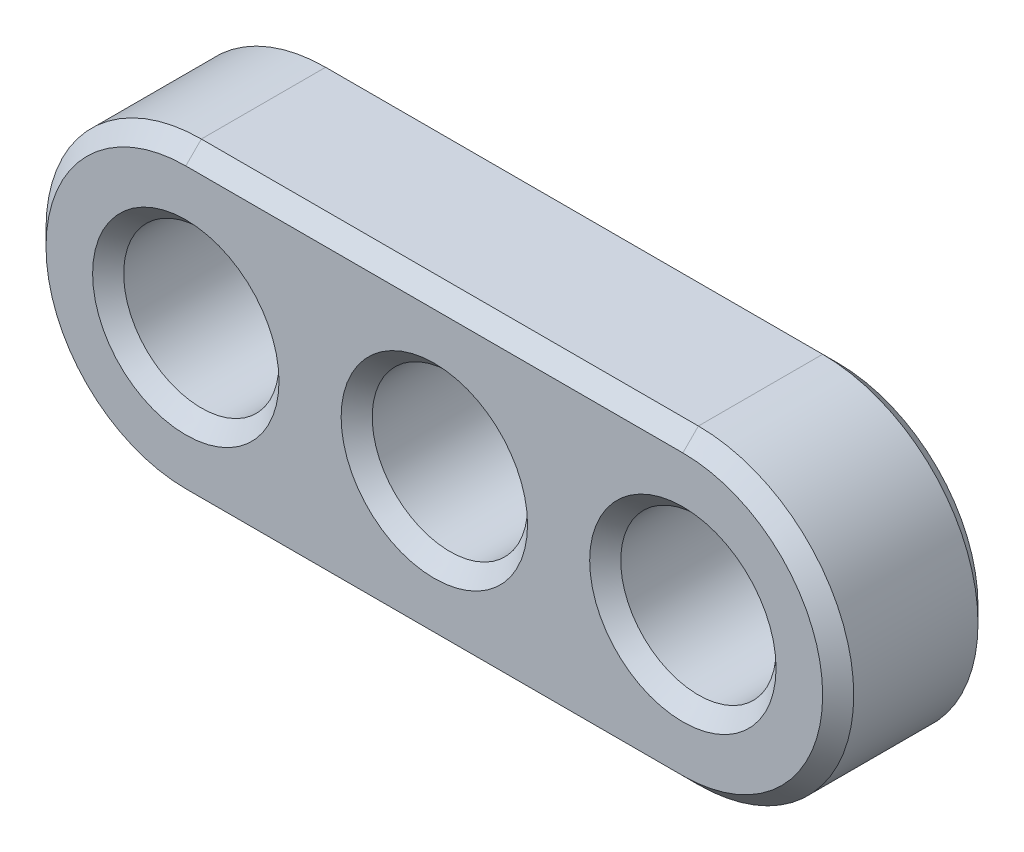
SolidWorks part; units mm, degrees
ref_plane "Plan de face" through (0, 0, 0) normal (0, 0, 1) x (1, 0, 0)
ref_plane "Plan de dessus" through (0, 0, 0) normal (0, 1, 0) x (1, 0, 0)
ref_plane "Plan de droite" through (0, 0, 0) normal (1, 0, 0) x (0, 0, -1)
sketch "Esquisse1" plane through (0, 0, 0) normal (0, 0, 1) x (1, 0, 0)
  line L0 (12, 0) -> (-12, 0) construction
  line L1 (12, -7.5) -> (-12, -7.5)
  line L2 (12, 7.5) -> (-12, 7.5)
  arc A0 (12, -7.5) -> (12, 7.5) centre (12, 0) ccw
  arc A1 (-12, 7.5) -> (-12, -7.5) centre (-12, 0) ccw
  circle A2 centre (-12, 0) radius 3.75
  circle A3 centre (0, 0) radius 3.75
  circle A4 centre (12, 0) radius 3.75
  point P2 (0, 0)
  dimension "D2" = 7.5
  dimension "D3" = 7.5
  dimension "D1" = 24
extrude "Boss.-Extru.1" add sketch "Esquisse1" along normal blind 7.5
chamfer "Chanfrein1" distance 0.75 angle 45 14 edges at (15.75, 0, 0) (3.75, 0, 0) (-8.25, 0, 0) (0, 7.5, 0) (-19.5, 0, 0) (0, -7.5, 0) (19.5, 0, 0) (15.75, 0, 7.5) (-8.25, 0, 7.5) (0, -7.5, 7.5) (-19.5, 0, 7.5) (0, 7.5, 7.5) (19.5, 0, 7.5) (3.75, 0, 7.5)
